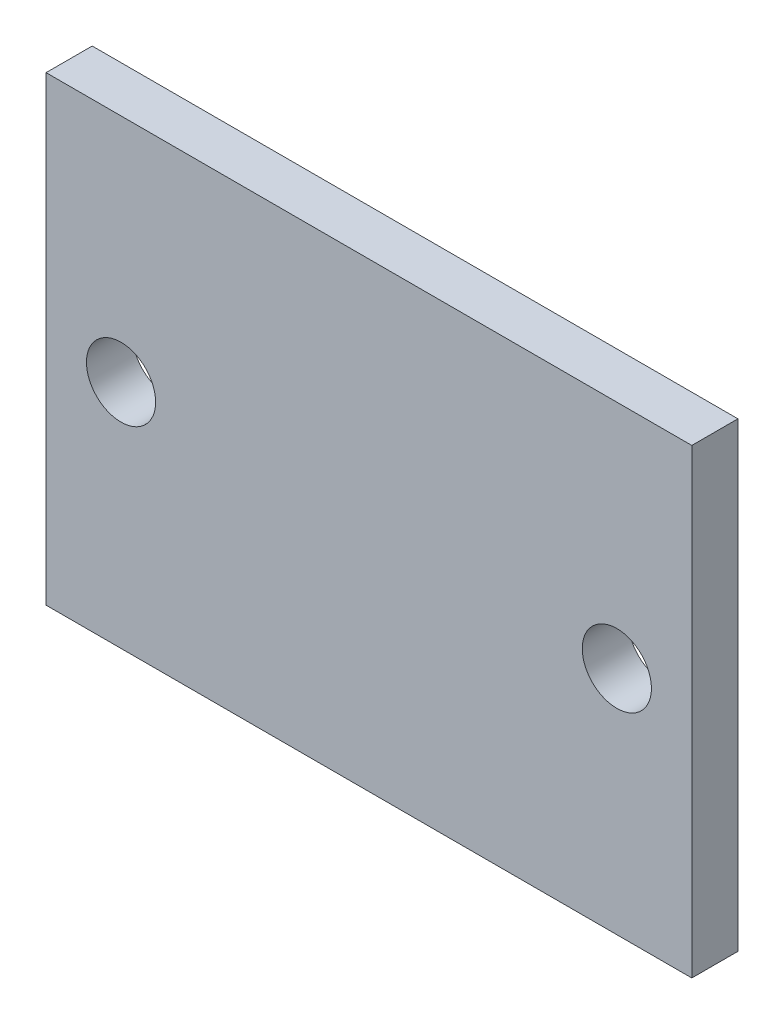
SolidWorks part; units mm, degrees
ref_plane "Planta" through (0, 0, 0) normal (0, 0, 1) x (1, 0, 0)
ref_plane "Perfil" through (0, 0, 0) normal (0, 1, 0) x (1, 0, 0)
ref_plane "Alzado" through (0, 0, 0) normal (1, 0, 0) x (0, 0, -1)
sketch "Croquis1" plane through (0, 0, 0) normal (0, 0, 1) x (1, 0, 0)
  line L1 (14, -10) -> (-14, -10)
  line L2 (14, -10) -> (14, 10)
  line L3 (14, 10) -> (-14, 10)
  line L4 (-14, -10) -> (-14, 10)
  line L5 (14, -10) -> (-14, 10) construction
  line L6 (14, 10) -> (-14, -10) construction
  point P0 (0, 0)
  dimension "D1" = 20
  dimension "D2" = 28
extrude "Saliente-Extruir1" add sketch "Croquis1" along normal blind 2
sketch "Croquis2" plane through (0, 0, 2) normal (0, 0, 1) x (1, 0, 0)
  line L0 (1.1, 0) -> (-1.1, 0) construction
  line L1 (-14, 10) -> (-14, -10) construction
  line L4 (-14, -10) -> (14, -10) construction
  line L5 (14, -10) -> (14, 10) construction
  circle A0 centre (-10.75, 0) radius 1.5
  circle A1 centre (10.75, 0) radius 1.5
  dimension "D1" = 21.5
  dimension "D2" = 3.25
  dimension "D3" = 3
extrude "Cortar-Extruir1" cut sketch "Croquis2" against normal up to next
